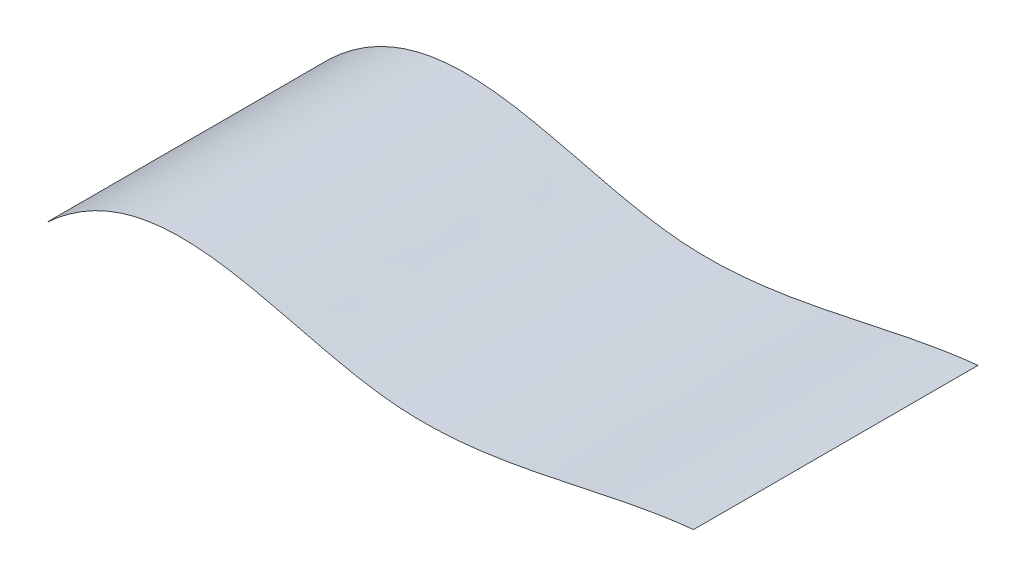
SolidWorks part; units mm, degrees
ref_plane "Front Plane" through (0, 0, 0) normal (0, 0, 1) x (1, 0, 0)
ref_plane "Top Plane" through (0, 0, 0) normal (0, 1, 0) x (1, 0, 0)
ref_plane "Right Plane" through (0, 0, 0) normal (1, 0, 0) x (0, 0, -1)
sketch "Sketch1" plane through (0, 0, 0) normal (0, 0, 1) x (1, 0, 0)
  spline S0 degree 3 poles (-72.9778, -31.3403) (-41.0315, -1.4902) (19.083, -42.2701) (81.4967, -17.7746) (109.1711, -15.0005) knots 0 0 0 0 0.54188 1 1 1 1
surface "Surface-Extrude1" sketch "Sketch1" parameters "D1"=80
